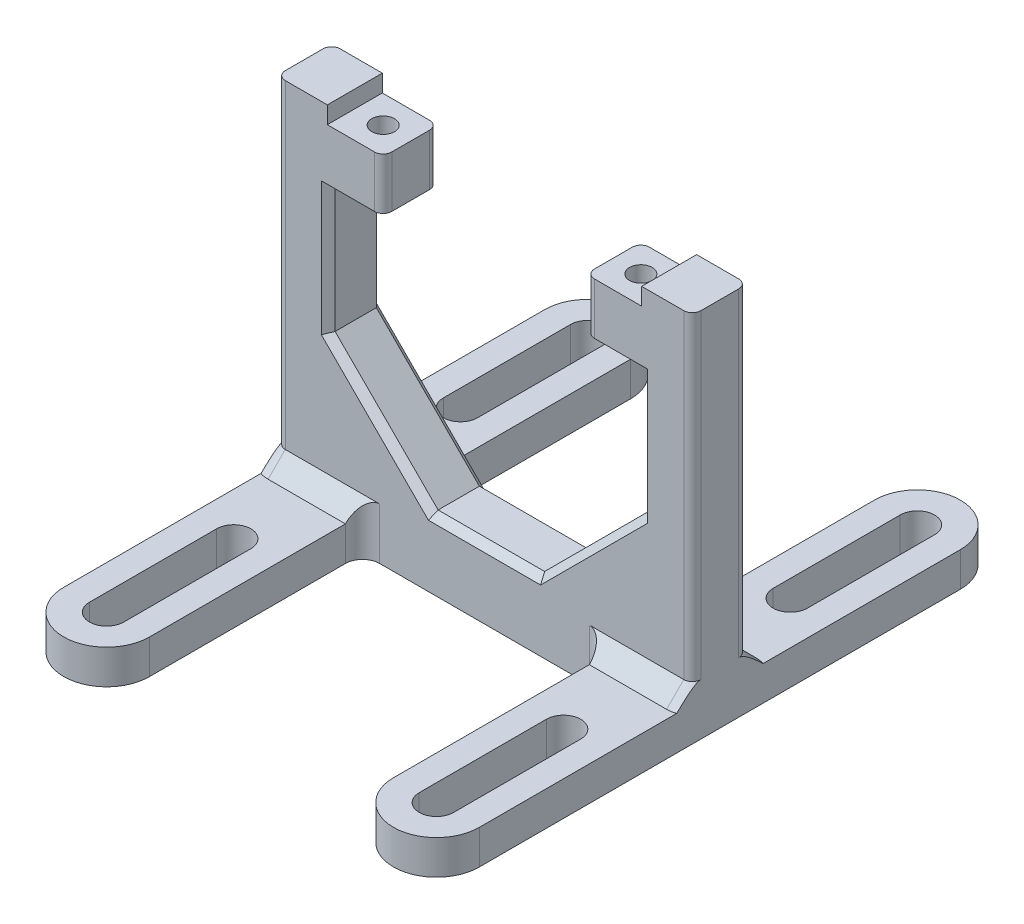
SolidWorks part; units mm, degrees
ref_plane "Ebene vorne" through (0, 0, 0) normal (0, 0, 1) x (1, 0, 0)
ref_plane "Ebene oben" through (0, 0, 0) normal (0, 1, 0) x (1, 0, 0)
ref_plane "Ebene rechts" through (0, 0, 0) normal (1, 0, 0) x (0, 0, -1)
sketch "Skizze2" plane through (0, 0, 0) normal (0, 0, 1) x (1, 0, 0)
  line L0 (0, 0) -> (0, -103) construction
  line L1 (-45.5, 0) -> (45.5, 0)
  line L2 (45.5, 0) -> (45.5, 5)
  line L3 (45.5, 5) -> (60.5, 5)
  line L4 (60.5, 5) -> (60.5, -103)
  line L5 (60.5, -103) -> (-60.5, -103)
  line L6 (-45.5, -83) -> (45.5, -83)
  line L7 (45.5, -83) -> (45.5, -15)
  line L8 (45.5, -15) -> (-45.5, -15)
  line L9 (-60.5, 5) -> (-60.5, -103)
  line L10 (-45.5, 5) -> (-60.5, 5)
  line L11 (-45.5, 0) -> (-45.5, 5)
  line L12 (-45.5, -83) -> (-45.5, -15)
  point P12 (0, -83)
  point P17 (0, -15)
  dimension "D1" = 91
  dimension "D2" = 15
  dimension "D3" = 5
  dimension "D4" = 103
  dimension "D5" = 20
  dimension "D6" = 15
extrude "Aufsatz-Linear austragen1" add sketch "Skizze2" along normal blind 16
hole_wizard "Ø6.6 (6.6) Durchmesser Bohrung1" positions "Skizze3" profile "Skizze4" hole size "Ø6.6" standard "DIN"
sketch "Skizze3" plane through (0, 0, 0) normal (0, 1, 0) x (1, 0, 0)
  line L0 (0, 0) -> (0, -16) construction
  line L1 (45.5, -16) -> (-45.5, -16) construction
  line L4 (0, -8) -> (-37.5, -8) construction
  line L6 (-45.5, -16) -> (-45.5, 0) construction
  point P0 (-37.5, -8)
  point P16 (37.5, -8)
  dimension "D1" = 8
sketch "Skizze4" plane through (-37.5, 0, 8) normal (1, 0, 0) x (0, 0, 1)
  line L0 (0, 0) -> (0, 15)
  line L1 (0, 15) -> (3.3, 15)
  line L2 (3.3, 15) -> (3.3, 0)
  line L5 (3.3, 0) -> (0, 0)
  line L11 (0, -6.35) -> (0, 107.95) construction
  dimension "Bohrerdurchmesser" = 6.6
  dimension "Bohrungstiefe" = 15
chamfer "Fase2" distance 30 angle 45 2 edges at (45.5, -83, 8) (-45.5, -83, 8)
fillet "Verrundung2" radius 2.5 4 edges at (-60.5, -49, 0) (60.5, -49, 16) (60.5, -49, 0) (-60.5, -49, 16)
chamfer "Fase3" distance 2 angle 45 10 edges at (45.5, -34, 0) (-45.5, -34, 0) (30.5, -68, 0) (0, -83, 0) (-30.5, -68, 0) (45.5, -34, 16) (30.5, -68, 16) (0, -83, 16) (-45.5, -34, 16) (-30.5, -68, 16)
sketch "Skizze5" plane through (0, -103, 0) normal (0, -1, 0) x (1, 0, 0)
  line L0 (-48, 78) -> (-48, -62) construction
  line L1 (-35.5, 78) -> (-35.5, -62)
  line L2 (-60.5, 78) -> (-60.5, -62)
  line L3 (0, 0) -> (0, 16) construction
  line L4 (-58, 16) -> (58, 16) construction
  line L5 (-48, 8) -> (0, 8) construction
  line L6 (-60.5, 13.5) -> (-60.5, 2.5) construction
  line L7 (-48, 78) -> (-48, 41) construction
  line L8 (-43, 78) -> (-43, 41)
  line L9 (-53, 78) -> (-53, 41)
  line L10 (-48, -62) -> (-48, -25) construction
  line L11 (-43, -62) -> (-43, -25)
  line L12 (-53, -62) -> (-53, -25)
  line L13 (48, -62) -> (48, -25) construction
  line L14 (43, -62) -> (43, -25)
  line L15 (53, -62) -> (53, -25)
  line L16 (48, 78) -> (48, 41) construction
  line L17 (43, 78) -> (43, 41)
  line L18 (53, 78) -> (53, 41)
  line L19 (48, 78) -> (48, -62) construction
  line L20 (35.5, 78) -> (35.5, -62)
  line L21 (60.5, 78) -> (60.5, -62)
  arc A0 (-35.5, 78) -> (-60.5, 78) centre (-48, 78) ccw
  arc A1 (-60.5, -62) -> (-35.5, -62) centre (-48, -62) ccw
  arc A2 (-43, 78) -> (-53, 78) centre (-48, 78) ccw
  arc A3 (-53, 41) -> (-43, 41) centre (-48, 41) ccw
  arc A4 (-43, -62) -> (-53, -62) centre (-48, -62) cw
  arc A5 (-53, -25) -> (-43, -25) centre (-48, -25) cw
  arc A6 (43, -62) -> (53, -62) centre (48, -62) ccw
  arc A7 (53, -25) -> (43, -25) centre (48, -25) ccw
  arc A8 (43, 78) -> (53, 78) centre (48, 78) cw
  arc A9 (53, 41) -> (43, 41) centre (48, 41) cw
  arc A10 (35.5, 78) -> (60.5, 78) centre (48, 78) cw
  arc A11 (60.5, -62) -> (35.5, -62) centre (48, -62) cw
  point P2 (-48, 8)
  point P14 (-48, 59.5)
  point P23 (-53, 59.5)
  point P26 (-48, -43.5)
  point P33 (48, -43.5)
  point P40 (48, 59.5)
  point P47 (48, 8)
  dimension "D1" = 25
  dimension "D2" = 140
  dimension "D3" = 25
  dimension "D4" = 10
extrude "Aufsatz-Linear austragen2" add sketch "Skizze5" against normal blind 10
fillet "Verrundung1" radius 5 4 edges at (-35.5, -98, 0) (35.5, -98, 16) (35.5, -98, 0) (-35.5, -98, 16)
chamfer "Fase4" distance 5 angle 45 8 edges at (-59.7678, -93, 0.7322) (-44.25, -93, 0) (59.7678, -93, 0.7322) (44.25, -93, 0) (59.7678, -93, 15.2678) (44.25, -93, 16) (-59.7678, -93, 15.2678) (-44.25, -93, 16)
sketch "Skizze6" plane through (0, 0, 16) normal (0, 0, 1) x (1, 0, 0)
  line L0 (-29.5, 0) -> (29.5, 0)
  line L1 (45.5, 0) -> (-45.5, 0) construction
  line L2 (0, 0) -> (0, -15) construction
  line L3 (47.5, -15) -> (-47.5, -15) construction
  line L4 (29.5, -15) -> (-29.5, -15)
  line L5 (-29.5, -15) -> (-29.5, 0)
  line L6 (-45.5, 0) -> (-45.5, 5) construction
  line L7 (29.5, -15) -> (29.5, 0)
  dimension "D1" = 16
extrude "Schnitt-Linear austragen1" cut sketch "Skizze6" against normal through all
fillet "Verrundung3" radius 2.5 4 edges at (29.5, -7.5, 16) (29.5, -7.5, 0) (-29.5, -7.5, 0) (-29.5, -7.5, 16)
other "Fläche verschieben1" parameters "D1"=0.25
other "Fläche verschieben2" parameters "D1"=0.25
